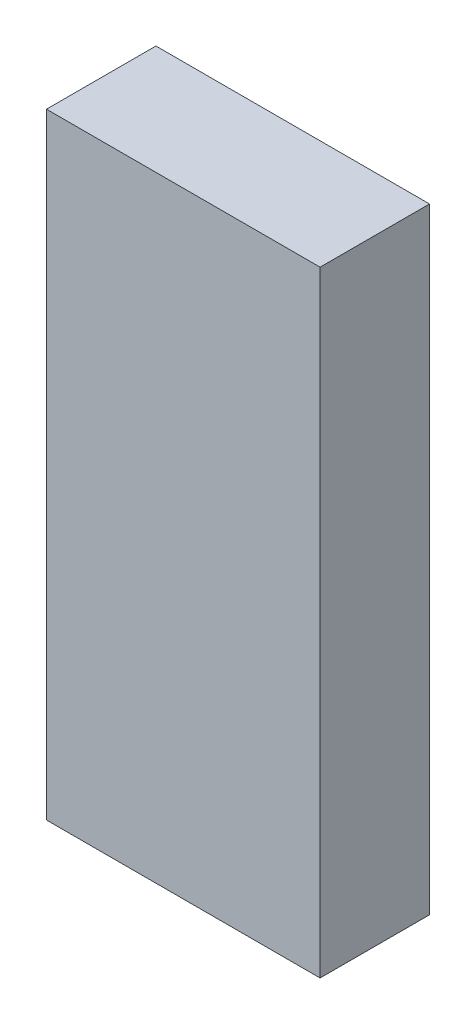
SolidWorks part; units mm, degrees
ref_plane "Plan de face" through (0, 0, 0) normal (0, 0, 1) x (1, 0, 0)
ref_plane "Plan de dessus" through (0, 0, 0) normal (0, 1, 0) x (1, 0, 0)
ref_plane "Plan de droite" through (0, 0, 0) normal (1, 0, 0) x (0, 0, -1)
sketch "Esquisse1" plane through (0, 0, 0) normal (0, 0, 1) x (1, 0, 0)
  line L1 (0, 0) -> (20, 0)
  line L2 (0, 0) -> (0, 45)
  line L3 (0, 45) -> (20, 45)
  line L4 (20, 0) -> (20, 45)
  dimension "D1" = 20
  dimension "D2" = 45
extrude "Extrusion1" add sketch "Esquisse1" along normal blind 8
